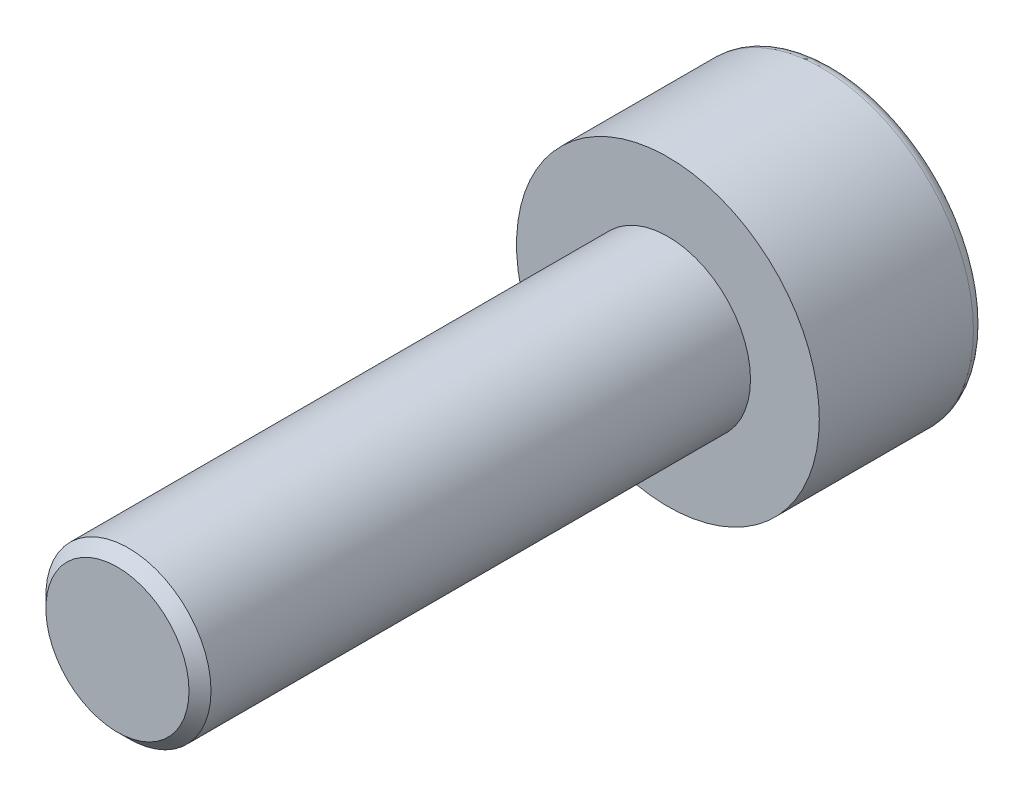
SolidWorks part; units mm, degrees
ref_plane "Plan de face" through (0, 0, 0) normal (0, 0, 1) x (1, 0, 0)
ref_plane "Plan de dessus" through (0, 0, 0) normal (0, 1, 0) x (1, 0, 0)
ref_plane "Plan de droite" through (0, 0, 0) normal (1, 0, 0) x (0, 0, -1)
sketch "Esquisse1" plane through (0, 0, 0) normal (0, 0, 1) x (1, 0, 0)
  circle A0 centre (0, 0) radius 2.75
  dimension "D1" = 5.5
extrude "Boss.-Extru.1" add sketch "Esquisse1" along normal blind 3
sketch "Esquisse2" plane through (0, 0, 3) normal (0, 0, 1) x (1, 0, 0)
  circle A0 centre (0, 0) radius 1.5
  dimension "D1" = 3
extrude "Boss.-Extru.2" add sketch "Esquisse2" along normal blind 10
chamfer "Chanfrein1" distance 0.2 angle 45 1 edges at (1.5, 0, 13)
fillet "Congé1" radius 0.2 1 edges at (2.75, 0, 0)
sketch "Esquisse3" plane through (0, 0, 0) normal (0, 0, -1) x (-1, 0, 0)
  line L1 (1.4434, 0) -> (0.7217, 1.25)
  line L2 (0.7217, 1.25) -> (-0.7217, 1.25)
  line L3 (-0.7217, 1.25) -> (-1.4434, 0)
  line L4 (-1.4434, 0) -> (-0.7217, -1.25)
  line L5 (-0.7217, -1.25) -> (0.7217, -1.25)
  line L6 (0.7217, -1.25) -> (1.4434, 0)
  circle A0 centre (0, 0) radius 1.25 construction
  dimension "D1" = 2.5
extrude "Enlèv. mat.-Extru.1" cut sketch "Esquisse3" against normal blind 2.5
